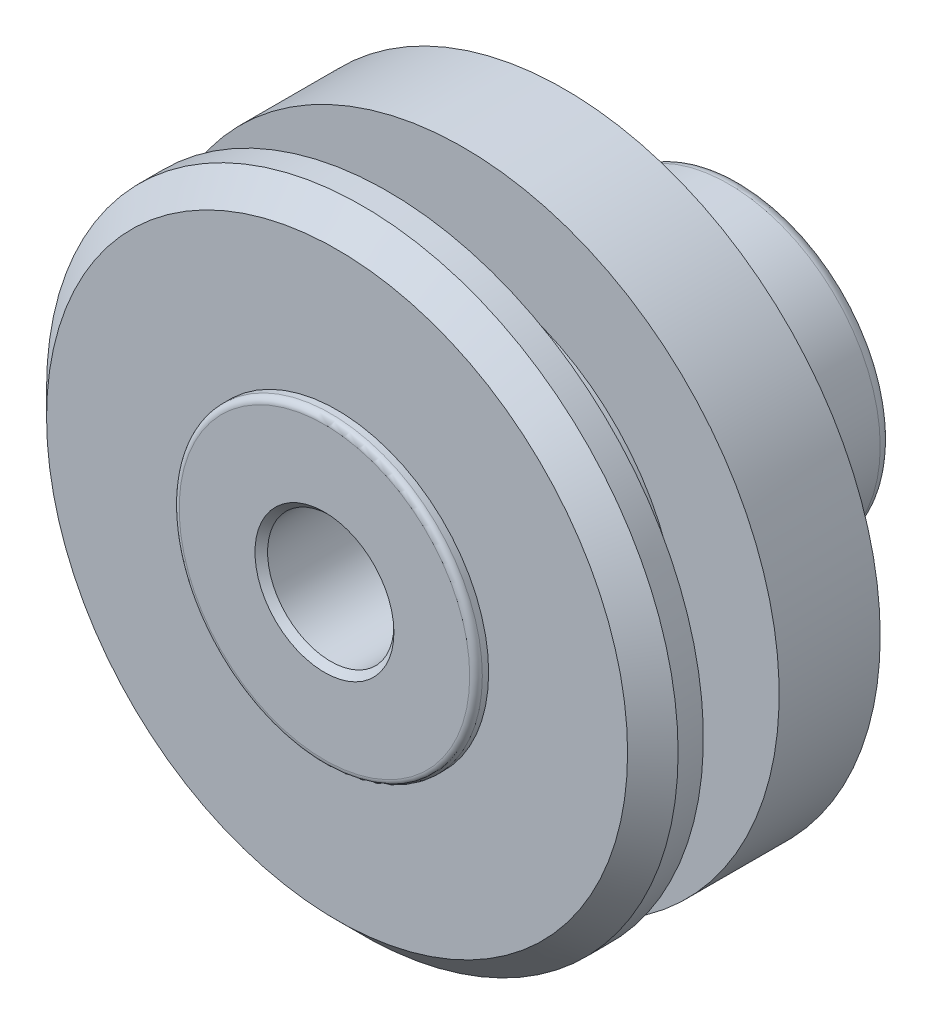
SolidWorks part; units mm, degrees
ref_plane "Face" through (0, 0, 0) normal (0, 0, 1) x (1, 0, 0)
ref_plane "Dessus" through (0, 0, 0) normal (0, 1, 0) x (1, 0, 0)
ref_plane "Droite" through (0, 0, 0) normal (1, 0, 0) x (0, 0, -1)
sketch "Esquisse1" plane through (0, 0, 0) normal (0, 0, 1) x (1, 0, 0)
  circle A0 centre (0, 0) radius 12.5
  dimension "D1" = 25
extrude "Extrusion1" add sketch "Esquisse1" along normal blind 9
chamfer "Chanfrein1" distance 1 angle 45
sketch "Esquisse2" plane through (0, 0, 0) normal (0, 1, 0) x (1, 0, 0)
  line L0 (0, 4.459) -> (0, -15.2129) construction
  line L1 (12.5, -8) -> (12.5, 0) construction
  line L2 (12.5, -4) -> (8.5, -4)
  line L3 (12.5, -4) -> (12.5, -7)
  line L4 (12.5, -7) -> (8.5, -7)
  line L5 (8.5, -4) -> (8.5, -7)
  line L6 (-11.5, -9) -> (11.5, -9) construction
  dimension "D1" = 3
  dimension "D2" = 17
  dimension "D3" = 2
revolve "Enlèvement de matière-Révolution1" cut sketch "Esquisse2" angle 360 about L0
sketch "Esquisse3" plane through (0, 0, 9) normal (0, 0, 1) x (1, 0, 0)
  circle A0 centre (0, 0) radius 6
  dimension "D1" = 12
extrude "Extrusion2" add sketch "Esquisse3" along normal blind 0.5
fillet "Congé1" radius 0.25
sketch "Esquisse4" plane through (0, 0, 9.5) normal (0, 0, 1) x (1, 0, 0)
  circle A0 centre (0, 0) radius 2.5
  dimension "D1" = 5
extrude "Enlèv. mat.-Extru.1" cut sketch "Esquisse4" against normal blind 7
sketch "Esquisse5" plane through (0, 0, 0) normal (0, 0, -1) x (-1, 0, 0)
  circle A0 centre (0, 0) radius 9.5
  circle A1 centre (0, 0) radius 6
  dimension "D1" = 12
  dimension "D2" = 19
extrude "Enlèv. mat.-Extru.5" cut sketch "Esquisse5" against normal blind 2.5
sketch "Esquisse6" plane through (0, 0, 0) normal (0, 0, -1) x (-1, 0, 0)
  circle A0 centre (0, 0) radius 6 construction
  circle A1 centre (0, 0) radius 6
extrude "Extrusion3" add sketch "Esquisse6" along normal blind 7
fillet "Congé2" radius 0.5
chamfer "Chanfrein2" distance 0.25 angle 45
sketch "Esquisse7" plane through (0, 0, -7) normal (0, 0, -1) x (-1, 0, 0)
  circle A0 centre (0, 0) radius 3 construction
  circle A1 centre (0, 0) radius 3
extrude "Enlèv. mat.-Extru.6" cut sketch "Esquisse7" against normal blind 6.5
sketch "Esquisse8" plane through (0, 0, 2.5) normal (0, 0, 1) x (1, 0, 0)
  circle A0 centre (0, 0) radius 1.5
  dimension "D1" = 3
extrude "Enlèv. mat.-Extru.7" cut sketch "Esquisse8" against normal through all
